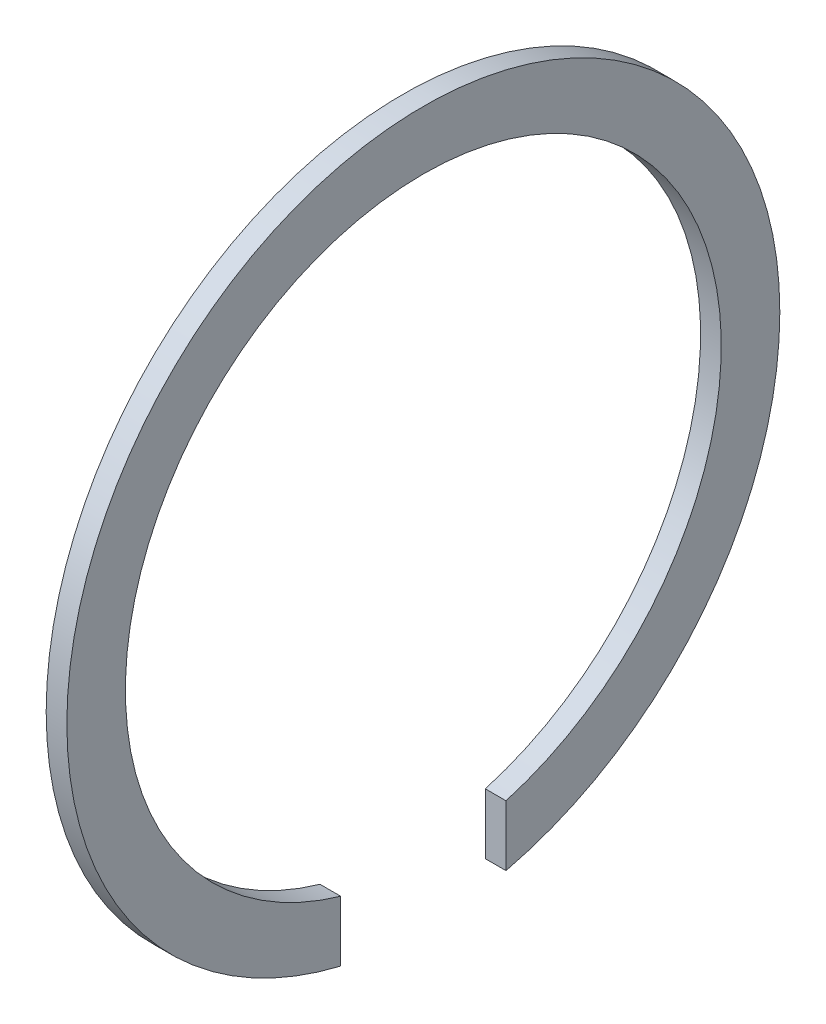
SolidWorks part; units mm, degrees
ref_plane "Face" through (0, 0, 0) normal (0, 0, 1) x (1, 0, 0)
ref_plane "Cote" through (0, 0, 0) normal (0, 1, 0) x (1, 0, 0)
ref_plane "Dessus" through (0, 0, 0) normal (1, 0, 0) x (0, 0, -1)
sketch "Esquisse1" plane through (0, 0, 0) normal (0, 0, 1) x (1, 0, 0)
  line L0 (0, 0) -> (-24.6016, 0) construction
  line L2 (-3, 51.75) -> (0, 51.75)
  line L3 (-3, 51.75) -> (-3, 43.25)
  line L4 (-3, 43.25) -> (0, 43.25)
  line L5 (0, 51.75) -> (0, 43.25)
  dimension "Ø Intérieur" = 86.5
  dimension "Ø Extérieur" = 103.5
  dimension "Epaisseur" = 3
revolve "Révolution1" add sketch "Esquisse1" angle 360 about L0
sketch "Esquisse2" plane through (0, 0, 0) normal (1, 0, 0) x (0, 0, -1)
  line L0 (0, 54.3468) -> (0, -54.6382) construction
  line L1 (-55.9495, 0) -> (54.2011, 0) construction
sketch "Esquisse3" plane through (0, 0, 0) normal (1, 0, 0) x (0, 0, -1)
  line L0 (0, 54.3468) -> (0, -54.6382) construction
  line L1 (-12, -0.3104) -> (12, -0.3104)
  line L2 (-12, -0.3104) -> (-12, -413.8808)
  line L3 (-12, -413.8808) -> (12, -413.8808)
  line L4 (12, -0.3104) -> (12, -413.8808)
  dimension "Milieu Encoche" = 12
  dimension "Encoche" = 24
extrude "Enlèv. mat.-Extru.1" cut sketch "Esquisse3" against normal through all
